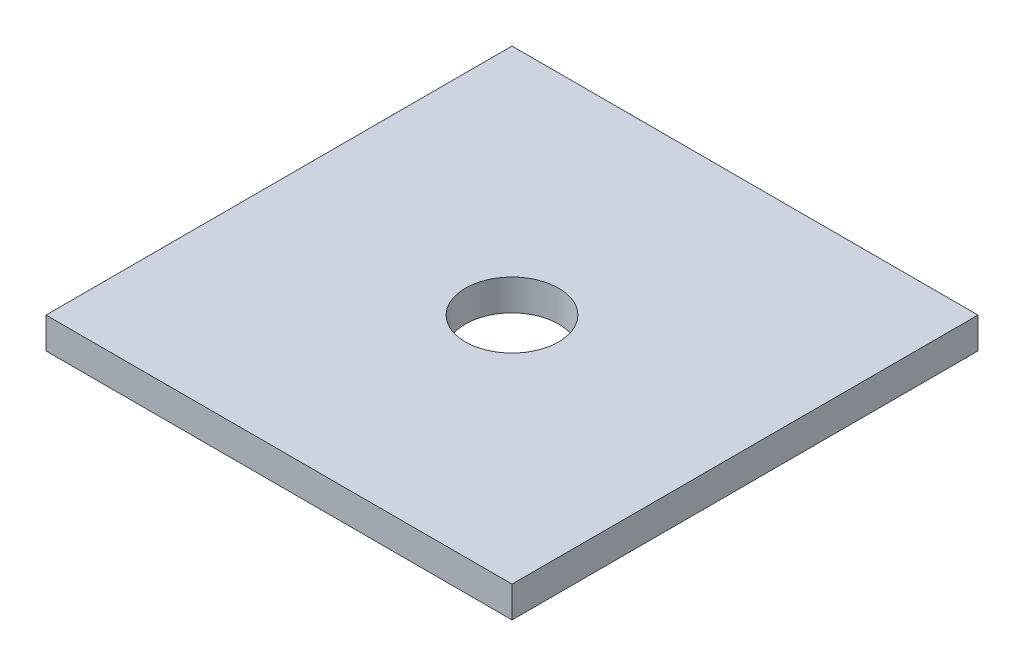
SolidWorks part; units mm, degrees
ref_plane "Front Plane" through (0, 0, 0) normal (0, 0, 1) x (1, 0, 0)
ref_plane "Top Plane" through (0, 0, 0) normal (0, 1, 0) x (1, 0, 0)
ref_plane "Right Plane" through (0, 0, 0) normal (1, 0, 0) x (0, 0, -1)
sketch "Sketch1" plane through (0, 0, 0) normal (0, 1, 0) x (1, 0, 0)
  line L0 (45, 45) -> (0, 0) construction
  line L1 (0, 0) -> (45, 0)
  line L2 (0, 0) -> (0, 45)
  line L3 (0, 45) -> (45, 45)
  line L4 (45, 0) -> (45, 45)
  circle A0 centre (22.5, 22.5) radius 4.5
  dimension "D3" = 9
  dimension "D1" = 45
  dimension "D2" = 45
extrude "Extrude1" add sketch "Sketch1" along normal blind 3
